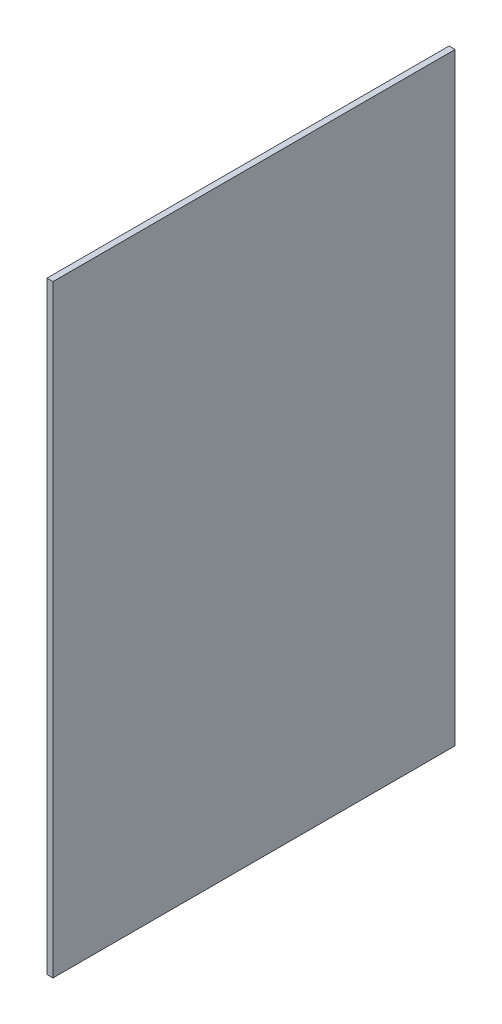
SolidWorks part; units mm, degrees
ref_plane "Vorderansicht" through (0, 0, 0) normal (0, 0, 1) x (1, 0, 0)
ref_plane "Draufsicht" through (0, 0, 0) normal (0, 1, 0) x (1, 0, 0)
ref_plane "Seitenansicht" through (0, 0, 0) normal (1, 0, 0) x (0, 0, -1)
sketch "Skizze1" plane through (0, 0, 0) normal (1, 0, 0) x (0, 0, -1)
  line L0 (0, 0) -> (0, 265.9469) construction
  line L1 (-100, 150) -> (100, 150)
  line L2 (-100, 150) -> (-100, -150)
  line L3 (-100, -150) -> (100, -150)
  line L4 (100, 150) -> (100, -150)
  line L5 (0, 80.2983) -> (0, -80.2983) construction
  line L6 (0, 0) -> (-219.861, 0) construction
  line L7 (79.0553, 0) -> (-79.0553, 0) construction
  dimension "D1" = 300
  dimension "D2" = 200
extrude "Linear austragen1" add sketch "Skizze1" along normal blind 3
